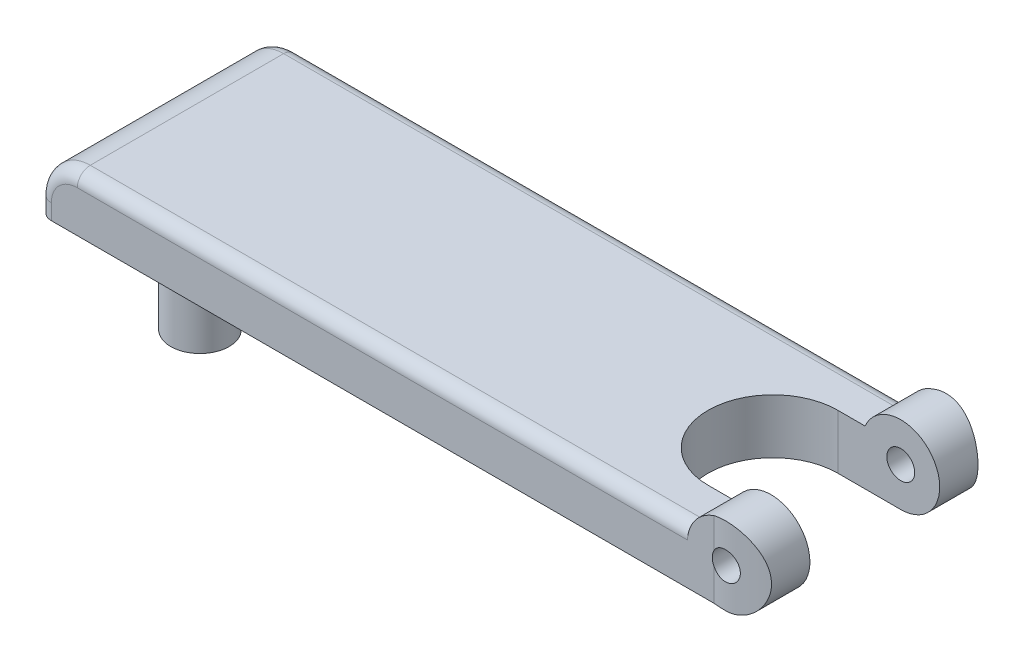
SolidWorks part; units mm, degrees
ref_plane "Plan de face" through (0, 0, 0) normal (0, 0, 1) x (1, 0, 0)
ref_plane "Plan de dessus" through (0, 0, 0) normal (0, 1, 0) x (1, 0, 0)
ref_plane "Plan de droite" through (0, 0, 0) normal (1, 0, 0) x (0, 0, -1)
sketch "Esquisse1" plane through (0, 0, 0) normal (0, 1, 0) x (1, 0, 0)
  line L1 (-53, 8.5) -> (0, 8.5)
  line L2 (-53, 8.5) -> (-53, -8.5)
  line L3 (-53, -8.5) -> (0, -8.5)
  line L4 (0, 8.5) -> (0, -8.5)
  dimension "D1" = 17
  dimension "D2" = 8.5
  dimension "D3" = 53
extrude "Extrusion1" add sketch "Esquisse1" along normal blind 4.2
sketch "Esquisse2" plane through (0, 0, 8.5) normal (0, 0, 1) x (1, 0, 0)
  circle A0 centre (0, 3) radius 3
  dimension "D1" = 6
extrude "Extrusion2" add sketch "Esquisse2" against normal blind 17
sketch "Esquisse5" plane through (0, 0, 8.5) normal (0, 0, 1) x (1, 0, 0)
  circle A0 centre (0, 3) radius 1.075
  arc A1 (0, 0) -> (-2.7495, 4.2) centre (0, 3) ccw construction
  dimension "D1" = 2.15
extrude "Enlèv. mat.-Extru.2" cut sketch "Esquisse5" against normal blind 17
sketch "Esquisse4" plane through (0, 0, 0) normal (0, -1, 0) x (1, 0, 0)
  line L0 (-0.9206, 8.45) -> (-54.6802, 8.45)
  line L1 (-54.6802, -8.45) -> (-0.9206, -8.45)
  line L4 (-54.6802, 8.45) -> (-54.6802, -8.45)
  line L5 (6.8739, 5) -> (-4.85, 5)
  line L7 (6.8739, -5) -> (-4.85, -5)
  arc A0 (-0.9206, -8.45) -> (6.8739, -5) centre (0, 0) ccw
  arc A1 (-4.85, 5) -> (-4.85, -5) centre (-4.85, 0) ccw
  arc A2 (6.8739, 5) -> (-0.9206, 8.45) centre (0, 0) ccw
  dimension "D1" = 16.9
  dimension "D3" = 5
  dimension "D4" = 4.85
extrude "Enlèv. mat.-Extru.1" cut sketch "Esquisse4" against normal blind 17 flip side to cut
fillet "Congé1" radius 3 1 edges at (-53, 4.2, 0)
sketch "Esquisse6" plane through (0, 0, 0) normal (0, -1, 0) x (1, 0, 0)
  line L0 (-53, -8.45) -> (-53, 8.45) construction
  circle A0 centre (-49, 0) radius 2.25
  circle A1 centre (-49, 0) radius 0.9
  point P2 (-53, 0)
  dimension "D2" = 4.5
  dimension "D3" = 1.8
  dimension "D1" = 4
fillet "Congé3" radius 1 6 edges at (-26.3748, 4.2, -8.45) (-52.1213, 3.3213, -8.45) (-26.3748, 4.2, 8.45) (-52.1213, 3.3213, 8.45) (-53, 0.6, -8.45) (-53, 0.6, 8.45)
extrude "Extrusion3" add sketch "Esquisse6" along normal blind 10
